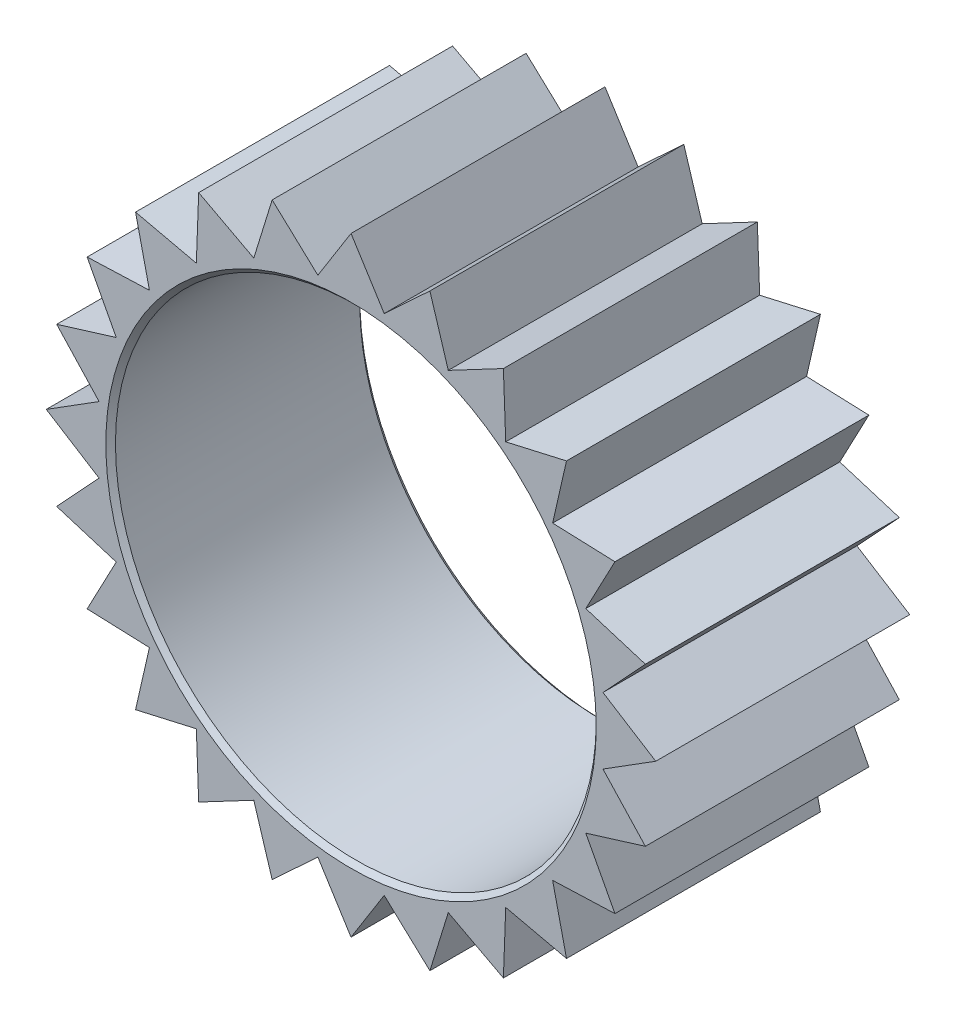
SolidWorks part; units mm, degrees
ref_plane "Front" through (0, 0, 0) normal (0, 0, 1) x (1, 0, 0)
ref_plane "Top" through (0, 0, 0) normal (0, 1, 0) x (1, 0, 0)
ref_plane "Right" through (0, 0, 0) normal (1, 0, 0) x (0, 0, -1)
sketch "Sketch Diameter" plane through (0, 0, 0) normal (0, 0, 1) x (1, 0, 0)
  line L0 (-304.8, 0) -> (304.8, 0) construction
  circle A0 centre (0, 0) radius 11.43 construction
  circle A1 centre (0, 0) radius 19.05 construction
  circle A2 centre (0, 0) radius 9.017
  circle A3 centre (0, 0) radius 9.5313
  point P8 (0, 11.43)
  point P9 (0, -11.43)
extrude "Boss-Extrude Diameter" add sketch "Sketch Diameter" against normal blind 9.525
sketch "Sketch Tooth" plane through (0, 0, 0) normal (0, 0, 1) x (1, 0, 0)
  line L0 (0, 0) -> (0, 11.43) construction
  line L1 (0, 0) -> (-1.2441, 9.4498) construction
  line L2 (0, 0) -> (1.4919, 11.3322) construction
  line L3 (-1.2441, 9.4498) -> (1.2441, 9.4498) construction
  line L6 (-1.2441, 9.4498) -> (0, 11.43)
  line L7 (0, 11.43) -> (1.2441, 9.4498)
  circle A0 centre (0, 0) radius 11.43 construction
  circle A2 centre (0, 0) radius 9.5313 construction
  arc A4 (1.2441, 9.4498) -> (-1.2441, 9.4498) centre (0, 0) ccw
  point P11 (0, 9.4498)
extrude "Boss-Extrude Tooth" add sketch "Sketch Tooth" against normal blind 9.525
pattern_circular "CirPattern Teeth" count 24 over 360 about axis through (0, 0, 0) along (0, 0, 1) of "Boss-Extrude Tooth"
chamfer "Chamfer Inner Circle" distance 0.1803 angle 45 2 edges at (9.017, 0, -9.525) (9.017, 0, 0)
equation "\"Pitch Dia@Sketch Diameter\" = \"Teeth@Sketch Diameter\" / 16"
equation "\"D1@Sketch Tooth\" = 360 / \"Teeth@Sketch Diameter\""
equation "\"D1@Boss-Extrude Tooth\" = \"D1@Boss-Extrude Diameter\""
equation "\"D1@CirPattern Teeth\" = \"Teeth@Sketch Diameter\""
equation "\"D1@Chamfer Inner Circle\" = \"Bore Dia.@Sketch Diameter\" * .01"
